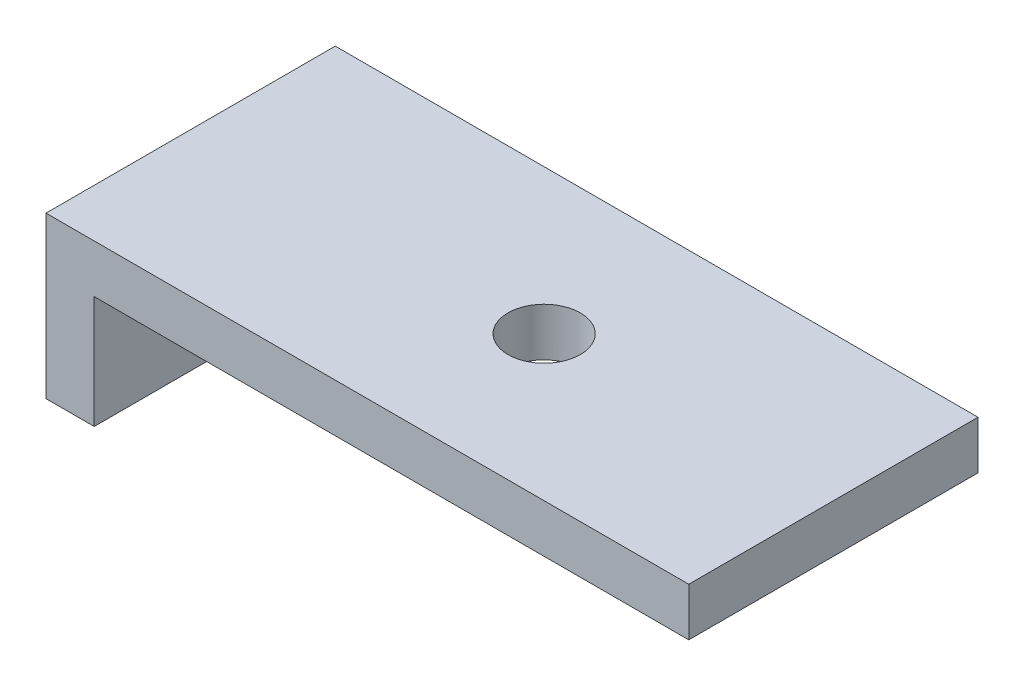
SolidWorks part; units mm, degrees
ref_plane "Front Plane" through (0, 0, 0) normal (0, 0, 1) x (1, 0, 0)
ref_plane "Top Plane" through (0, 0, 0) normal (0, 1, 0) x (1, 0, 0)
ref_plane "Right Plane" through (0, 0, 0) normal (1, 0, 0) x (0, 0, -1)
sketch "Sketch1" plane through (0, 0, 0) normal (0, 0, 1) x (1, 0, 0)
  line L0 (0, 0) -> (-3, 0)
  line L1 (-3, 0) -> (-3, 10)
  line L2 (-3, 10) -> (37, 10)
  line L3 (37, 10) -> (37, 7)
  line L4 (37, 7) -> (0, 7)
  line L5 (0, 7) -> (0, 0)
  dimension "D1" = 3
  dimension "D2" = 3
  dimension "D3" = 10
  dimension "D4" = 40
extrude "Boss-Extrude1" add sketch "Sketch1" along normal blind 18
sketch "Sketch2" plane through (0, 10, 0) normal (0, 1, 0) x (1, 0, 0)
  line L0 (37, -9) -> (-3, -9) construction
  line L1 (37, -18) -> (37, 0) construction
  line L2 (-3, -18) -> (-3, 0) construction
  circle A0 centre (19, -9) radius 2.25
  dimension "D1" = 4.5
  dimension "D2" = 18
extrude "Cut-Extrude1" cut sketch "Sketch2" against normal blind 10
